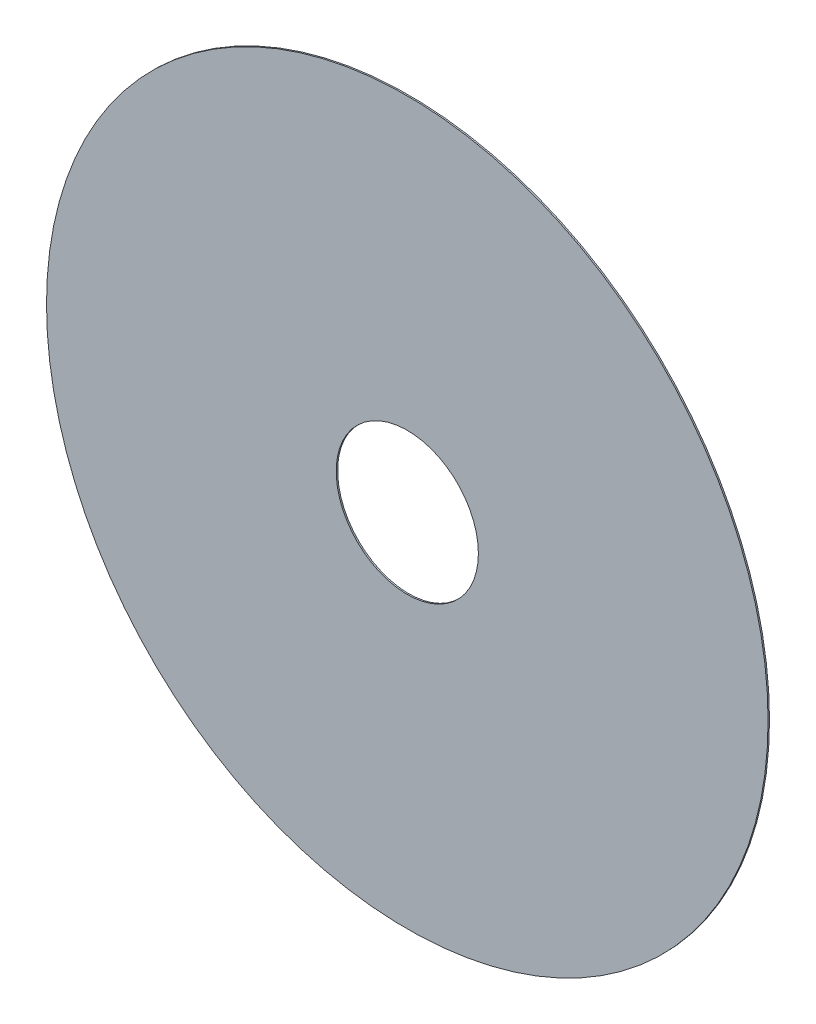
SolidWorks part; units mm, degrees
ref_plane "Front Plane" through (0, 0, 0) normal (0, 0, 1) x (1, 0, 0)
ref_plane "Top Plane" through (0, 0, 0) normal (0, 1, 0) x (1, 0, 0)
ref_plane "Right Plane" through (0, 0, 0) normal (1, 0, 0) x (0, 0, -1)
sketch "Sketch1" plane through (0, 0, 0) normal (0, 0, 1) x (1, 0, 0)
  circle A0 centre (0, 0) radius 507.5
  dimension "Outer dia" = 1015
base flange "Base-Flange1" sketch "Sketch1" thickness 2 reverse thickness direction no parameters "D1"=1
sketch "Sketch6" plane through (0, 0, 0) normal (0, 0, 1) x (1, 0, 0)
  circle A0 centre (0, 0) radius 100
  dimension "Inner dia" = 200
extrude "Cut-Extrude1" cut sketch "Sketch6" against normal blind 10
sketch "Bend-Lines1" [suppressed] plane through (0, 0, 0) normal (0, 1, 0) x (1, 0, 0)
sketch "Bounding-Box1" [suppressed] plane through (0, 0, 0) normal (0, 1, 0) x (1, 0, 0)
sheet metal parameters "Sheet-Metal1" thickness 2 parameters "D1"=1
flat pattern "Flat-Pattern1"
sketch "Bend-Lines2" plane through (0, 0, 0) normal (0, 1, 0) x (1, 0, 0)
sketch3d "Bounding-Box2" [suppressed]
  line L0 (-509.4107, -510.5879, 0) -> (510.5881, -509.4103, 0) construction
  line L1 (-510.5884, 509.4108, 0) -> (509.4105, 510.5885, 0) construction
  line L2 (-509.4107, -510.5879, 0) -> (-510.5884, 509.4108, 0) construction
  line L3 (510.5881, -509.4103, 0) -> (509.4105, 510.5885, 0) construction
sheet metal parameters "Sheet-Metal2" thickness 2 parameters "D1"=1
flat pattern "Flat-Pattern1"
sketch "Bend-Lines2" plane through (0, 0, 0) normal (0, 1, 0) x (1, 0, 0)
sketch3d "Bounding-Box2" [suppressed]
  line L0 (507.3263, 507.6734, 0) -> (507.6735, -507.3261, 0) construction
  line L1 (-507.673, 507.3261, 0) -> (-507.3258, -507.6734, 0) construction
  line L2 (507.3263, 507.6734, 0) -> (-507.673, 507.3261, 0) construction
  line L3 (507.6735, -507.3261, 0) -> (-507.3258, -507.6734, 0) construction
equation "\"Inner Dia 1\"= 360"
equation "\"Inner Dia 1.1\"= 370"
equation "\"Outer Dia 1\"= 1015"
equation "\"Outer Dia 1.1\"= 1025mm"
